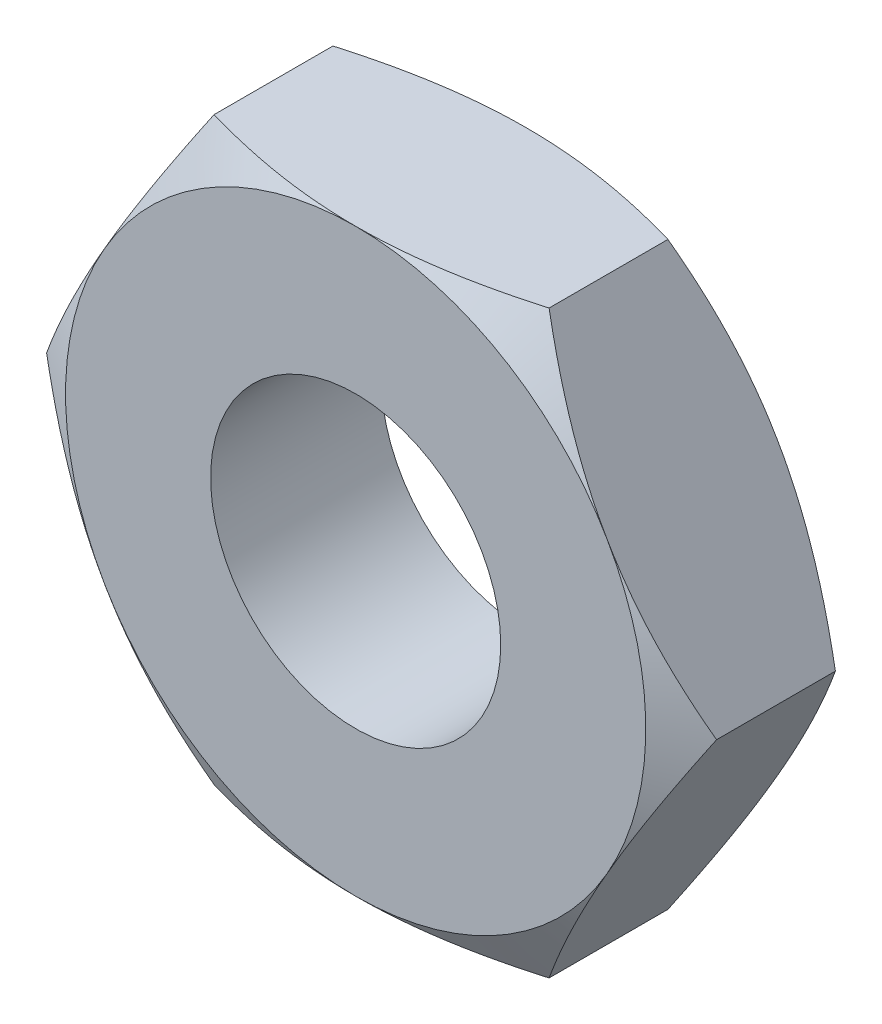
SolidWorks part; units mm, degrees
ref_plane "Front Plane" through (0, 0, 0) normal (0, 0, 1) x (1, 0, 0)
ref_plane "Top Plane" through (0, 0, 0) normal (0, 1, 0) x (1, 0, 0)
ref_plane "Right Plane" through (0, 0, 0) normal (1, 0, 0) x (0, 0, -1)
sketch "Sketch1" plane through (0, 0, 0) normal (0, 0, 1) x (1, 0, 0)
  line L1 (4.9075, -8.5) -> (9.815, 0)
  line L2 (9.815, 0) -> (4.9075, 8.5)
  line L3 (4.9075, 8.5) -> (-4.9075, 8.5)
  line L4 (-4.9075, 8.5) -> (-9.815, 0)
  line L5 (-9.815, 0) -> (-4.9075, -8.5)
  line L6 (-4.9075, -8.5) -> (4.9075, -8.5)
  circle A0 centre (0, 0) radius 8.5 construction
  dimension "D1" = 17
extrude "Extrude1" add sketch "Sketch1" along normal blind 5
hole_wizard " Tapped Hole1" positions "Sketch3" profile "Sketch2" tap size "M10" standard "DIN"
sketch "Sketch3" plane through (0, 0, 5) normal (0, 0, 1) x (1, 0, 0)
  point P0 (0, 0)
sketch "Sketch2" plane through (0, 0, 5) normal (1, 0, 0) x (0, -1, 0)
  line L0 (0, 0) -> (0, 5)
  line L1 (0, 5) -> (4.25, 5)
  line L2 (4.25, 5) -> (4.25, 0)
  line L5 (4.25, 0) -> (0, 0)
  line L11 (0, -6.35) -> (0, 107.95) construction
  dimension "Thru Tap Drill Dia." = 8.5
  dimension "Thru Tap Drill Depth" = 5
sketch "Sketch4" plane through (0, 0, 0) normal (0, 1, 0) x (1, 0, 0)
  line L0 (-9.815, -4.2408) -> (-8.5, -5)
  line L1 (-9.815, -5) -> (-9.815, 0) construction
  line L2 (-4.9075, -5) -> (-9.815, -5) construction
  line L3 (-9.815, -5) -> (-9.815, -4.2408)
  line L4 (-8.5, -5) -> (-9.815, -5)
  line L5 (-9.815, -2.5) -> (9.815, -2.5) construction
  line L6 (9.815, -5) -> (9.815, 0) construction
  line L7 (-9.815, -0.7592) -> (-8.5, 0)
  line L8 (-9.815, 0) -> (-9.815, -0.7592)
  line L9 (-8.5, 0) -> (-9.815, 0)
  line L10 (0, 0) -> (0, -5) construction
  line L11 (4.9075, -5) -> (-4.9075, -5) construction
  dimension "D1" = 30
  dimension "D2" = 8.5
revolve "Cut-Revolve1" cut sketch "Sketch4" angle 360 about L10
